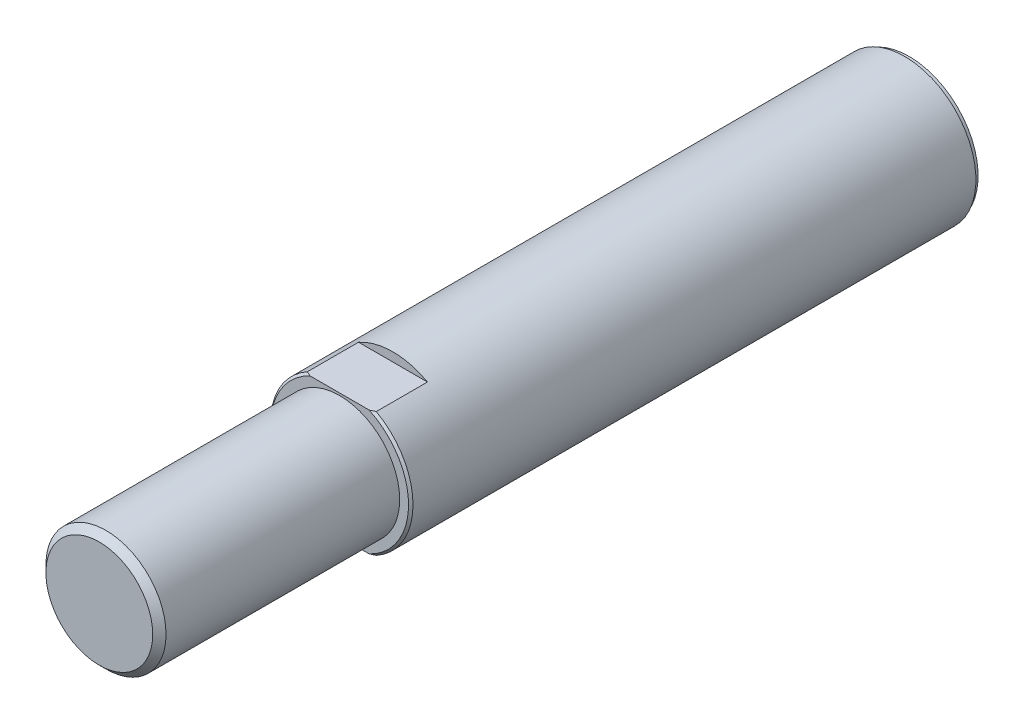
SolidWorks part; units mm, degrees
ref_plane "Plano frontal" through (0, 0, 0) normal (0, 0, 1) x (1, 0, 0)
ref_plane "Plano superior" through (0, 0, 0) normal (0, 1, 0) x (1, 0, 0)
ref_plane "Plano direito" through (0, 0, 0) normal (1, 0, 0) x (0, 0, -1)
sketch "Esboço1" plane through (0, 0, 0) normal (0, 0, 1) x (1, 0, 0)
  circle A0 centre (0, 0) radius 16
  dimension "D1" = 32
extrude "Ressalto-extrusão1" add sketch "Esboço1" along normal blind 182
sketch "Esboço2" plane through (0, 0, 182) normal (0, 0, 1) x (1, 0, 0)
  circle A0 centre (0, 0) radius 13.5
  dimension "D1" = 27
extrude "Corte-extrusão1" cut sketch "Esboço2" against normal blind 54 flip side to cut
hole_wizard "Furo roscado de M14x2.01" positions "Esboço3" profile "Esboço4" tap size "M14x2.0" standard "Ansi Metric"
sketch "Esboço3" plane through (0, 0, 0) normal (0, 0, -1) x (-1, 0, 0)
  point P0 (0, 0)
sketch "Esboço4" plane through (0, 0, 0) normal (1, 0, 0) x (0, 1, 0)
  line L0 (0, 0) -> (0, 53.6052)
  line L1 (0, 53.6052) -> (6, 50)
  line L2 (6, 50) -> (6, 0)
  line L5 (6, 0) -> (0, 0)
  line L10 (0, 53.6052) -> (-6, 50) construction
  line L11 (0, -6.35) -> (0, 107.95) construction
  dimension "Tap Drill Dia." = 12
  dimension "Tap Drill Depth" = 50
  dimension "Drill Angle" = 118
sketch "Esboço5" plane through (0, 0, 0) normal (0, 0, -1) x (-1, 0, 0)
  circle A0 centre (0, 0) radius 15.5
  dimension "D1" = 31
extrude "Corte-extrusão2" cut sketch "Esboço5" against normal blind 1 flip side to cut
chamfer "Chanfro1" distance 1.5 angle 45 1 edges at (13.5, 0, 182)
chamfer "Chanfro2" distance 0.5 angle 45 1 edges at (16, 0, 128)
sketch "Esboço6" plane through (0, 0, 128) normal (0, 0, 1) x (1, 0, 0)
  line L1 (-24.3714, -14) -> (24.3714, -14)
  line L2 (-24.3714, -14) -> (-24.3714, 14)
  line L3 (-24.3714, 14) -> (24.3714, 14)
  line L4 (24.3714, -14) -> (24.3714, 14)
  line L5 (-24.3714, -14) -> (24.3714, 14) construction
  line L6 (-24.3714, 14) -> (24.3714, -14) construction
  point P0 (0, 0)
  dimension "D1" = 28
extrude "Corte-extrusão3" cut sketch "Esboço6" against normal blind 12 flip side to cut
